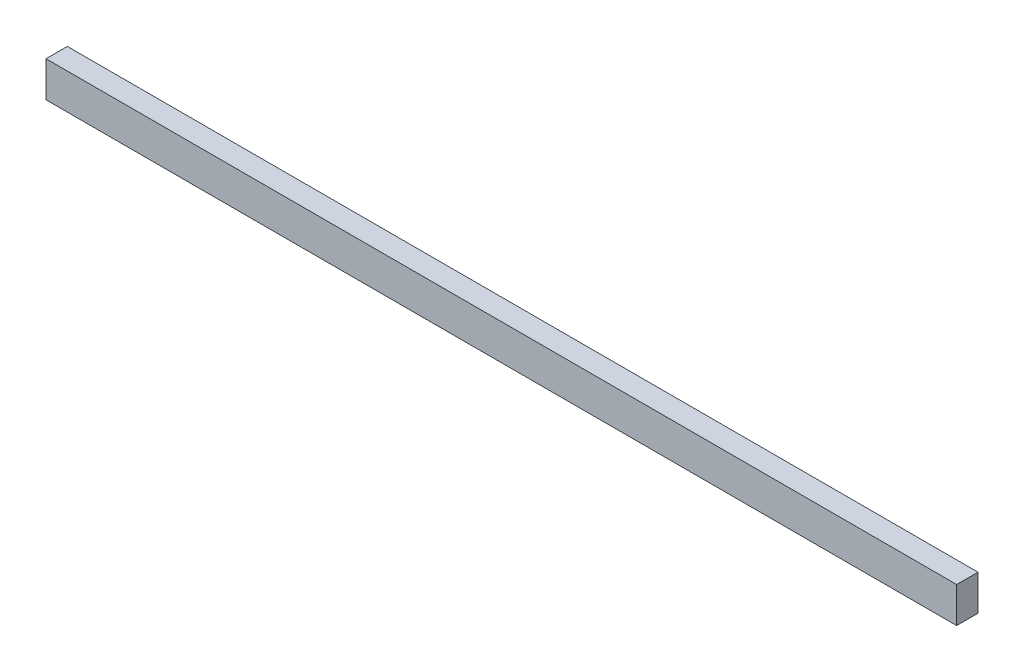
SolidWorks part; units mm, degrees
ref_plane "Front Plane" through (0, 0, 0) normal (1, 0, 0) x (0, 1, 0)
ref_plane "Top Plane" through (0, 0, 0) normal (0, 0, 1) x (0, 1, 0)
ref_plane "Right Plane" through (0, 0, 0) normal (0, 1, 0) x (-1, 0, 0)
sketch "Sketch1" plane through (0, 0, 0) normal (1, 0, 0) x (0, 1, 0)
  line L0 (-31.75, 0) -> (31.75, 0)
  line L1 (31.75, 0) -> (31.75, 38.1)
  line L2 (31.75, 38.1) -> (-31.75, 38.1)
  line L3 (-31.75, 38.1) -> (-31.75, 0)
extrude "Panel_or_block" add sketch "Sketch1" along normal blind 1625.6
